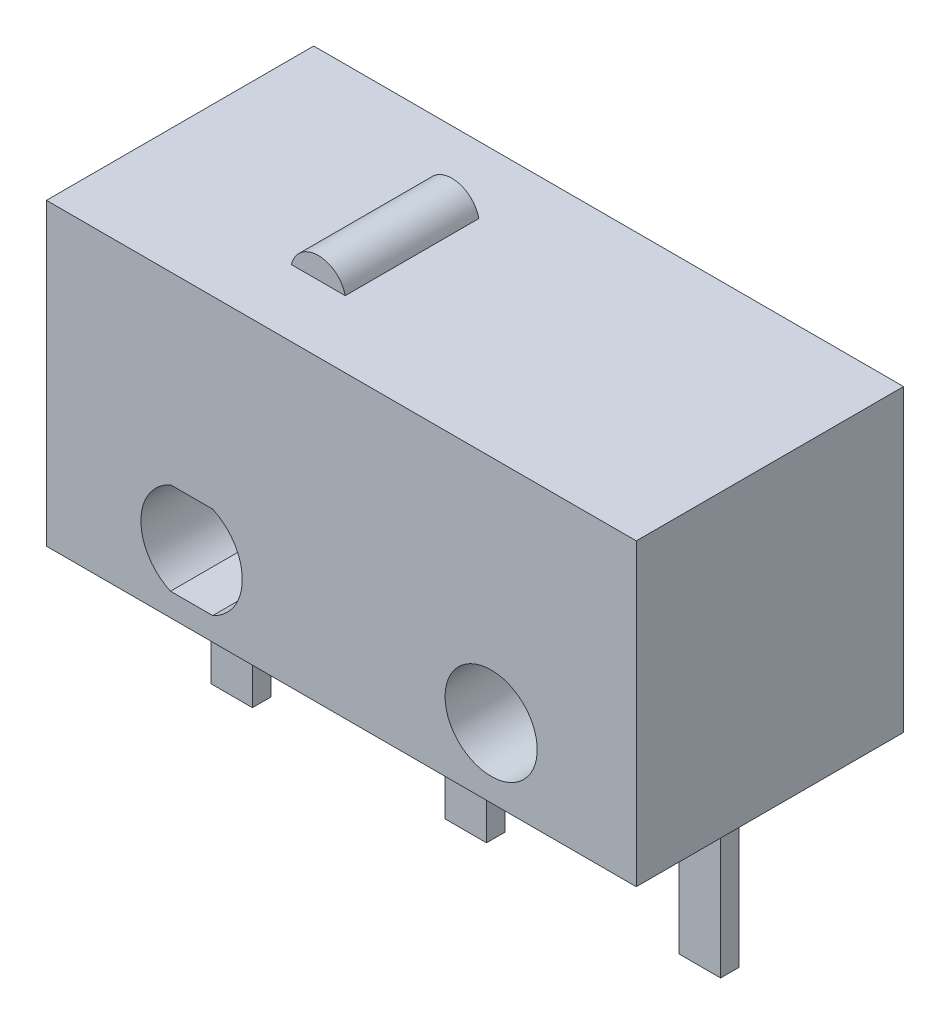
SolidWorks part; units mm, degrees
ref_plane "Front" through (0, 0, 0) normal (0, 0, 1) x (1, 0, 0)
ref_plane "Top" through (0, 0, 0) normal (0, 1, 0) x (1, 0, 0)
ref_plane "Right" through (0, 0, 0) normal (1, 0, 0) x (0, 0, -1)
ref_plane "Plane1" through (3.15, 0, 0) normal (1, 0, 0) x (0, 0, -1)
sketch "Sketch1" plane through (3.15, 0, 0) normal (1, 0, 0) x (0, 0, -1)
  line L0 (2.9, -1.5) -> (2.9, 5)
  line L1 (2.9, 5) -> (-2.9, 5)
  line L2 (-2.9, 5) -> (-2.9, -1.5)
  line L3 (-2.9, -1.5) -> (2.9, -1.5)
extrude "Extrude1" add sketch "Sketch1" against normal blind 12.8
sketch "Sketch2" plane through (0, 0, 2.9) normal (0, 0, 1) x (1, 0, 0)
  line L0 (-6.9583, -1) -> (-6.0417, -1)
  line L1 (-6.0417, 1) -> (-6.9583, 1)
  arc A0 (-6.9583, 1) -> (-6.9583, -1) centre (-6.5, 0) ccw
  arc A1 (-6.0417, -1) -> (-6.0417, 1) centre (-6.5, 0) ccw
extrude "Cut-Extrude1" cut sketch "Sketch2" against normal blind 5.8
sketch "Sketch3" plane through (0, 0, 2.9) normal (0, 0, 1) x (1, 0, 0)
  circle A0 centre (0, 0) radius 1
extrude "Cut-Extrude2" cut sketch "Sketch3" against normal blind 5.8
sketch "Sketch4" plane through (0, -1.5, 0) normal (0, -1, 0) x (1, 0, 0)
  line L0 (-7.88, 0.2) -> (-7.88, -0.2)
  line L1 (-7.88, -0.2) -> (-8.78, -0.2)
  line L2 (-8.78, -0.2) -> (-8.78, 0.2)
  line L3 (-8.78, 0.2) -> (-7.88, 0.2)
extrude "Extrude2" add sketch "Sketch4" along normal blind 3.5
sketch "Sketch5" plane through (0, -1.5, 0) normal (0, -1, 0) x (1, 0, 0)
  line L0 (-3.7, -0.2) -> (-3.7, 0.2)
  line L1 (-3.7, 0.2) -> (-2.8, 0.2)
  line L2 (-2.8, 0.2) -> (-2.8, -0.2)
  line L3 (-2.8, -0.2) -> (-3.7, -0.2)
extrude "Extrude3" add sketch "Sketch5" along normal blind 3.5
sketch "Sketch6" plane through (0, -1.5, 0) normal (0, -1, 0) x (1, 0, 0)
  line L0 (1.38, -0.2) -> (1.38, 0.2)
  line L1 (1.38, 0.2) -> (2.28, 0.2)
  line L2 (2.28, 0.2) -> (2.28, -0.2)
  line L3 (2.28, -0.2) -> (1.38, -0.2)
extrude "Extrude4" add sketch "Sketch6" along normal blind 3.5
ref_plane "Plane2" through (0, 0, -1.45) normal (0, 0, -1) x (-1, 0, 0)
sketch "Sketch7" plane through (0, 0, -1.45) normal (0, 0, -1) x (-1, 0, 0)
  line L0 (4.6156, 5) -> (5.7844, 5)
  arc A0 (5.7844, 5) -> (4.6156, 5) centre (5.2, 4.864) ccw
extrude "Extrude5" add sketch "Sketch7" against normal blind 2.9
